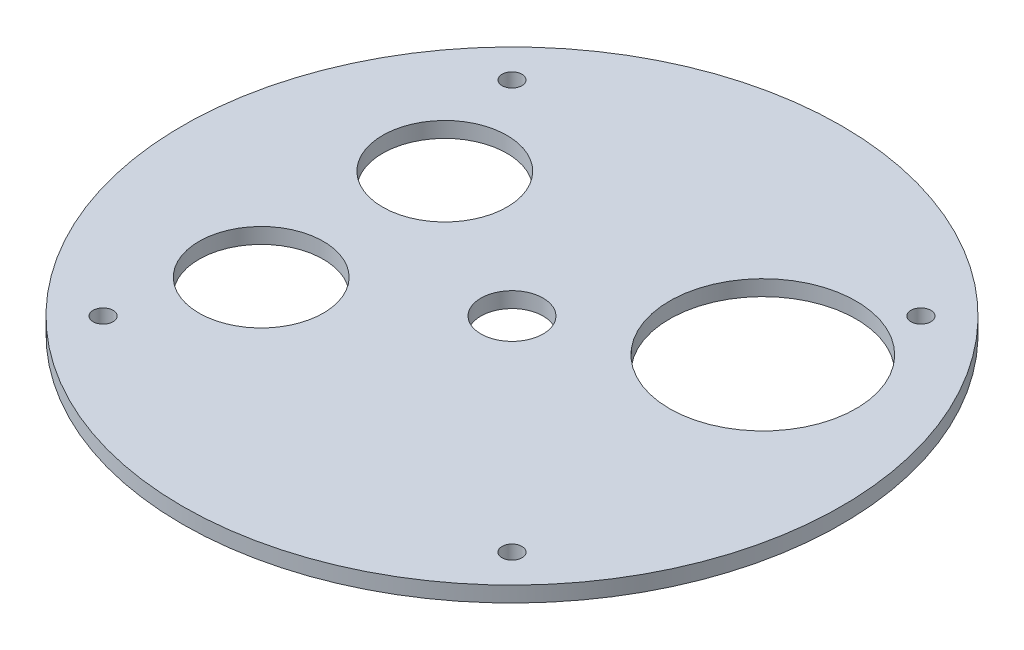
SolidWorks part; units mm, degrees
ref_plane "Front Plane" through (0, 0, 0) normal (0, 0, 1) x (1, 0, 0)
ref_plane "Top Plane" through (0, 0, 0) normal (0, 1, 0) x (1, 0, 0)
ref_plane "Right Plane" through (0, 0, 0) normal (1, 0, 0) x (0, 0, -1)
sketch "Sketch1" plane through (0, 0, 0) normal (0, 1, 0) x (1, 0, 0)
  circle A0 centre (0, 0) radius 67.31
  dimension "D1" = 134.62
extrude "Boss-Extrude1" add sketch "Sketch1" along normal blind 3.175
sketch "Sketch2" plane through (0, 3.175, 0) normal (0, 1, 0) x (1, 0, 0)
  line L0 (-31.75, 0) -> (31.75, 0)
  line L1 (31.75, -59.3513) -> (-31.75, -59.3513)
  line L2 (31.75, -59.3513) -> (31.75, 59.3513)
  line L3 (31.75, 59.3513) -> (-31.75, 59.3513)
  line L4 (-31.75, -59.3513) -> (-31.75, 59.3513)
  line L5 (31.75, -59.3513) -> (-31.75, 59.3513) construction
  line L6 (31.75, 59.3513) -> (-31.75, -59.3513) construction
  line L7 (31.75, 0) -> (45.1208, 0)
  line L8 (41.7582, 41.7582) -> (0, 0)
  line L9 (0, 0) -> (-41.7582, 41.7582)
  line L10 (0, 68.58) -> (0, -68.58)
  line L11 (-31.75, 0) -> (-45.1208, 0)
  line L12 (41.7582, -41.7582) -> (0, 0)
  line L13 (0, 0) -> (-41.7582, -41.7582)
  circle A0 centre (-32.476, 18.75) radius 12.7
  circle A2 centre (32.476, 18.75) radius 19.05
  circle A5 centre (-32.476, -18.75) radius 12.7
  circle A7 centre (19.5, -48.5) radius 1.65
  circle A8 centre (-19.5, -48.5) radius 1.65
  circle A9 centre (0, 0) radius 1.9197
  circle A10 centre (0, 0) radius 67.31 construction
  circle A11 centre (0, 0) radius 68.58
  circle A12 centre (41.7582, -41.7582) radius 2.032
  circle A13 centre (41.7582, 41.7582) radius 2.032
  circle A14 centre (-41.7582, 41.7582) radius 2.032
  circle A15 centre (-41.7582, -41.7582) radius 2.032
  circle A16 centre (0, -16) radius 2.5
  circle A17 centre (0, 16) radius 2.5
  circle A18 centre (0, 0) radius 59.055
  circle A19 centre (0, 0) radius 37.5
  dimension "D2" = 90
  dimension "D4" = 38.1
  dimension "D5" = 25.4
  dimension "D6" = 25.4
  dimension "D7" = 118.11
  dimension "D8" = 4.064
  dimension "D9" = 4.064
  dimension "D10" = 137.16
  dimension "D1" = 63.5
  dimension "D11" = 90
extrude "Cut-Extrude1" cut sketch "Sketch2" against normal through all contours A13 A18 L8 | A18 A13 | L8 A18 A13 | L9 A18 A14 | A14 A18 L9 | L13 A18 A15 | A15 A18 L13 | A18 A15 | A18 A12 | L12 A18 A12 | A12 A18 L12 | L2 A2 | L2 A2 L8 | L8 A2 | L4 A0 | L4 A0 | L4 A5 | L4 A5 | A19 L8 L2 A2 | A19 L2 L8 | A2 A19 L2 L7 | L8 A2 L2 | A5 A19 L4 | A19 L4 A5 L13 | A19 L13 A5 | L13 A19 A5 | L4 A19 A0 | A19 L9 A0 L4 | A0 A19 L9 | L2 A2 L7 | L0 A2 L2 | A9
sketch "Sketch3" plane through (0, 3.175, 0) normal (0, 1, 0) x (1, 0, 0)
  circle A0 centre (0, 0) radius 6.35
extrude "Cut-Extrude2" cut sketch "Sketch3" against normal through all
chamfer "Chamfer3" [suppressed] distance 1.5875 angle 45
chamfer "Chamfer5" [suppressed] distance 1.5875 angle 45
